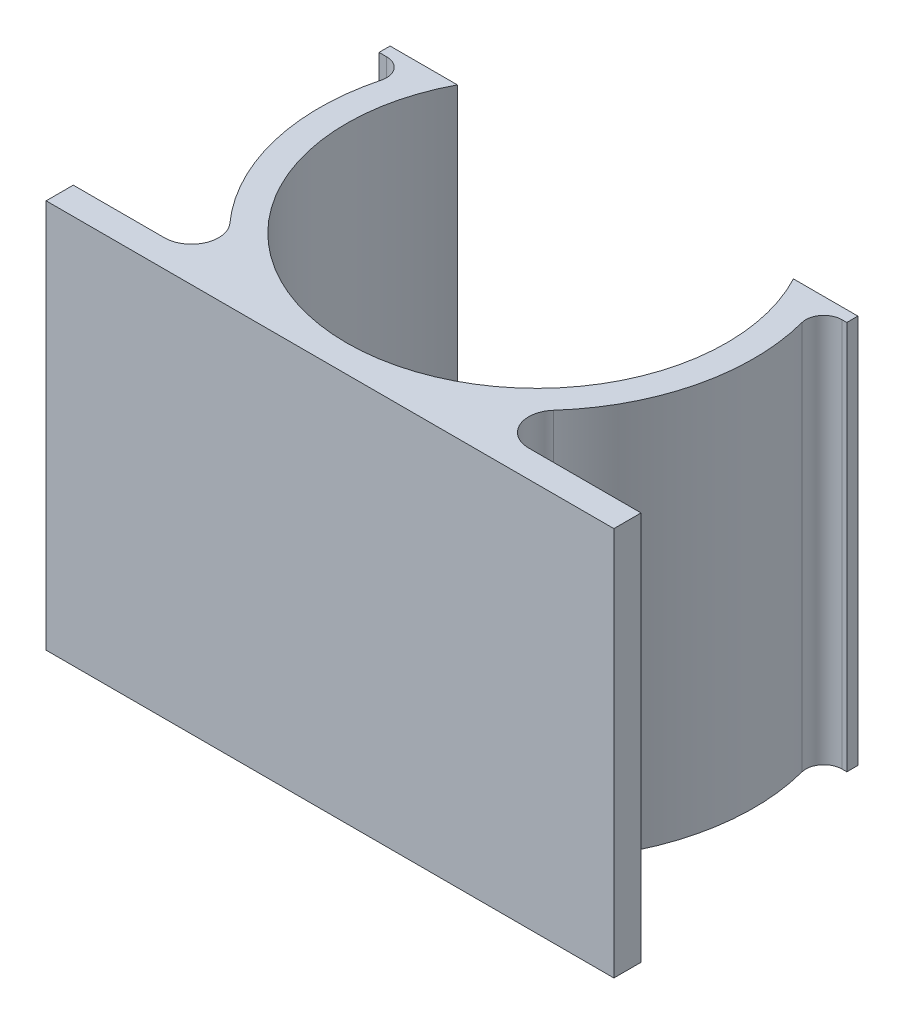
SolidWorks part; units mm, degrees
ref_plane "Front" through (0, 0, 0) normal (0, 0, 1) x (1, 0, 0)
ref_plane "Top" through (0, 0, 0) normal (0, 1, 0) x (1, 0, 0)
ref_plane "Right" through (0, 0, 0) normal (1, 0, 0) x (0, 0, -1)
sketch "Sketch1" plane through (0, 0, 0) normal (0, 1, 0) x (1, 0, 0)
  line L0 (16.2689, -12) -> (-15.0951, -12)
  line L1 (-15.0951, -12) -> (-15.0951, -10.5)
  line L2 (16.2689, -12) -> (16.2689, -10.5)
  line L3 (16.2689, -10.5) -> (10.0623, -10.5)
  line L4 (12.8414, 4.2961) -> (12.5752, 4.2961)
  line L5 (-12.5752, 4.2961) -> (-13, 4.2961)
  line L6 (-10.0623, -10.5) -> (-15.0951, -10.5)
  line L7 (16.2689, -10.5) -> (-15.0951, -10.5) construction
  line L8 (12.8414, 4.2961) -> (12.8414, 4.9065)
  line L9 (12.8414, 4.9065) -> (9.2831, 4.9065)
  line L10 (-13, 4.9065) -> (-13, 4.2961)
  line L11 (-9.2831, 4.9065) -> (-13, 4.9065)
  arc A0 (-9.2831, 4.9065) -> (9.2831, 4.9065) centre (0, 0) ccw
  arc A1 (-11.6079, 3.0426) -> (-8.9443, -8) centre (0, 0) ccw
  circle A2 centre (0, 0) radius 12 construction
  circle A3 centre (0, 0) radius 10.5 construction
  arc A4 (8.9443, -8) -> (11.6079, 3.0426) centre (0, 0) ccw
  arc A5 (-10.0623, -10.5) -> (-8.9443, -8) centre (-10.0623, -9) ccw
  arc A6 (10.0623, -10.5) -> (8.9443, -8) centre (10.0623, -9) cw
  arc A7 (-11.6079, 3.0426) -> (-12.5752, 4.2961) centre (-12.5752, 3.2961) ccw
  arc A8 (11.6079, 3.0426) -> (12.5752, 4.2961) centre (12.5752, 3.2961) cw
  point P23 (-11.2046, 4.2961)
extrude "Extrude1" add sketch "Sketch1" along normal blind 21.5
